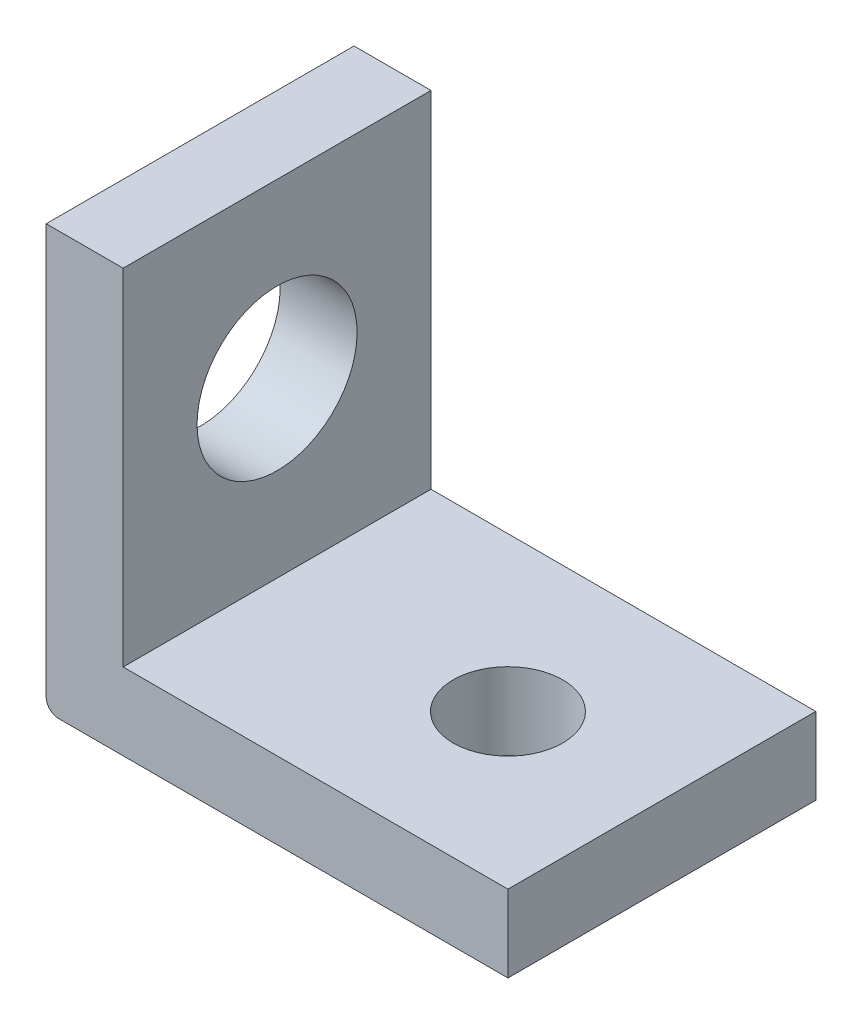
SolidWorks part; units mm, degrees
ref_plane "Front Plane" through (0, 0, 0) normal (0, 0, 1) x (1, 0, 0)
ref_plane "Top Plane" through (0, 0, 0) normal (0, 1, 0) x (1, 0, 0)
ref_plane "Right Plane" through (0, 0, 0) normal (1, 0, 0) x (0, 0, -1)
sketch "Sketch1" plane through (0, 0, 0) normal (0, 0, 1) x (1, 0, 0)
  line L0 (0, 0) -> (0, 7.1247)
  line L1 (0, 7.1247) -> (-1.5875, 7.1247)
  line L2 (-1.5875, 7.1247) -> (-1.5875, -1.3335)
  line L3 (-1.3335, -1.5875) -> (7.9375, -1.5875)
  line L4 (7.9375, -1.5875) -> (7.9375, 0)
  line L5 (7.9375, 0) -> (0, 0)
  arc A1 (-1.5875, -1.3335) -> (-1.3335, -1.5875) centre (-1.3335, -1.3335) ccw
  point P9 (0, 0)
  point P12 (-1.5875, -1.5875)
  dimension "D1" = 9.525
  dimension "D2" = 8.7122
  dimension "D3" = 1.5875
  dimension "D4" = 1.5875
extrude "Boss-Extrude1" add sketch "Sketch1" along normal blind 6.35
hole_wizard "#4 Clearance Hole1" positions "Sketch4" profile "Sketch2" hole size "#4" standard "Progressive"
sketch "Sketch4" plane through (0, 0, 0) normal (1, 0, 0) x (0, 0, -1)
  line L0 (-6.35, -1.5875) -> (0, -1.5875) construction
  line L1 (0, 0) -> (0, 7.1247) construction
  point P0 (-3.175, 3.5687)
  dimension "D1" = 5.1562
  dimension "D2" = 3.175
sketch "Sketch2" plane through (0, 3.5687, 3.175) normal (0, 1, 0) x (0, 0, -1)
  line L0 (0, 0) -> (0, 58.142)
  line L1 (0, 58.142) -> (1.651, 57.15)
  line L2 (1.651, 57.15) -> (1.651, 0)
  line L5 (1.651, 0) -> (0, 0)
  line L10 (0, 58.142) -> (-1.651, 57.15) construction
  line L11 (0, -6.35) -> (0, 107.95) construction
  dimension "Hole Dia." = 3.302
  dimension "Hole Depth" = 57.15
  dimension "Drill Angle" = 118
hole_wizard "#4-40 Tapped Hole1" positions "Sketch6" profile "Sketch5" tap size "#4-40" standard "ANSI Inch"
sketch "Sketch6" plane through (0, 0, 0) normal (0, 1, 0) x (1, 0, 0)
  line L0 (-1.5875, -6.35) -> (-1.5875, 0) construction
  line L1 (7.9375, -6.35) -> (0, -6.35) construction
  point P0 (4.7625, -3.175)
  dimension "D1" = 6.35
  dimension "D2" = 3.175
sketch "Sketch5" plane through (4.7625, 0, 3.175) normal (1, 0, 0) x (0, 0, 1)
  line L0 (0, 0) -> (0, 1.5875)
  line L1 (0, 1.5875) -> (1.1303, 1.5875)
  line L2 (1.1303, 1.5875) -> (1.1303, 0)
  line L5 (1.1303, 0) -> (0, 0)
  line L11 (0, -6.35) -> (0, 107.95) construction
  dimension "Thru Tap Drill Dia." = 2.2606
  dimension "Thru Tap Drill Depth" = 1.5875
